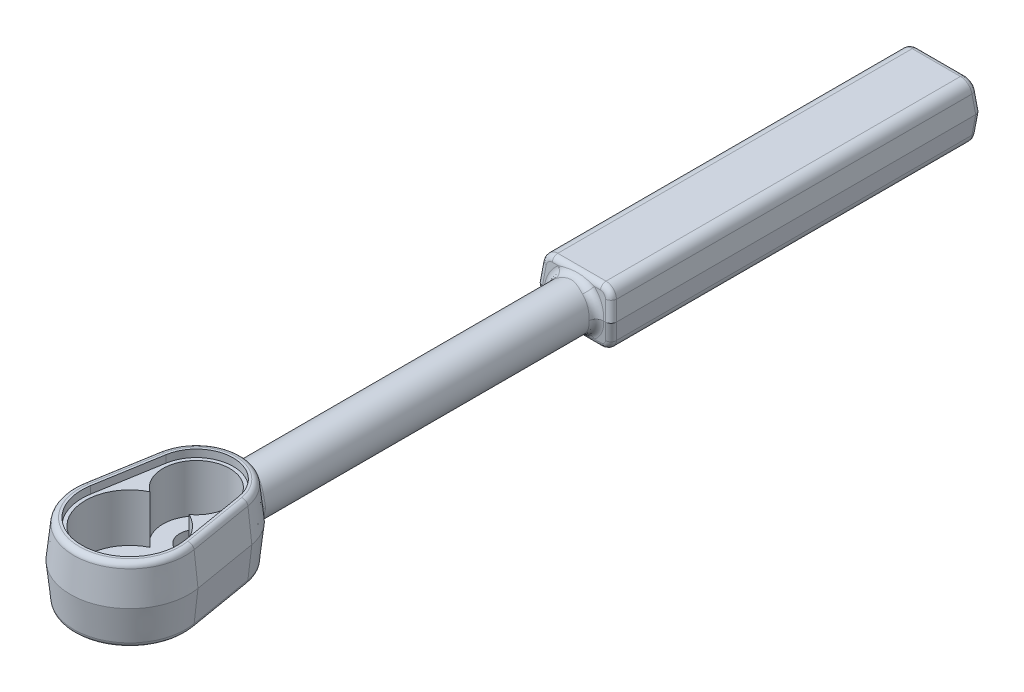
SolidWorks part; units mm, degrees
ref_plane "Front" through (0, 0, 0) normal (0, 0, 1) x (1, 0, 0)
ref_plane "Top" through (0, 0, 0) normal (0, 1, 0) x (1, 0, 0)
ref_plane "Right" through (0, 0, 0) normal (1, 0, 0) x (0, 0, -1)
sketch "Sketch2" plane through (0, 0, 0) normal (0, 1, 0) x (1, 0, 0)
  line L0 (0, 0) -> (0, 120) construction
  line L1 (-10, 220) -> (10, 220)
  line L2 (-10, 220) -> (-10, 120)
  line L3 (-10, 120) -> (10, 120)
  line L4 (10, 220) -> (10, 120)
  dimension "D1" = 220
  dimension "D2" = 20
  dimension "D3" = 100
extrude "Handle" add sketch "Sketch2" along normal mid plane 15 draft 6
sketch "Sketch3" plane through (0, 0, 0) normal (0, 0, 1) x (1, 0, 0)
  circle A0 centre (0, 0) radius 6
  dimension "D1" = 12
extrude "Transition" add sketch "Sketch3" against normal up to next
sketch "Sketch4" plane through (0, 0, 0) normal (0, 1, 0) x (1, 0, 0)
  line L0 (-15.7762, 2.6667) -> (-12.8182, 20.1667)
  line L1 (12.8182, 20.1667) -> (15.7762, 2.6667)
  line L2 (0, 0) -> (0, 39.2442) construction
  line L3 (0, 120) -> (0, 0) construction
  arc A0 (-12.8182, 20.1667) -> (12.8182, 20.1667) centre (0, 18) cw
  arc A1 (15.7762, 2.6667) -> (-15.7762, 2.6667) centre (0, 0) cw
  dimension "D1" = 13
  dimension "D2" = 16
  dimension "D3" = 18
extrude "Head" add sketch "Sketch4" along normal mid plane 20
sketch "Sketch5" plane through (0, 10, 0) normal (0, 1, 0) x (-1, 0, 0)
  line L6 (-12.7678, -2.1582) -> (-9.8098, -19.6582)
  line L7 (9.8098, -19.6582) -> (12.7678, -2.1582)
  line L8 (-12.7678, -2.1582) -> (-9.8098, -19.6582)
  line L9 (9.8098, -19.6582) -> (12.7678, -2.1582)
  arc A6 (12.7678, -2.1582) -> (-12.7678, -2.1582) centre (0, 0) ccw
  arc A7 (-9.8098, -19.6582) -> (9.8098, -19.6582) centre (0, -18) ccw
  arc A8 (12.7678, -2.1582) -> (-12.7678, -2.1582) centre (0, 0) ccw
  arc A9 (-9.8098, -19.6582) -> (9.8098, -19.6582) centre (0, -18) ccw
  dimension "D1" = 2
extrude "Recess" cut sketch "Sketch5" against normal blind 2
sketch "Sketch6" plane through (0, 8, 0) normal (0, 1, 0) x (-1, 0, 0)
  arc A0 (-5.3327, -10.75) -> (5.3327, -10.75) centre (0, -18) ccw
  arc A1 (5.3327, -10.75) -> (-5.3327, -10.75) centre (0, 0) ccw
  arc A3 (12.7678, -2.1582) -> (-12.7678, -2.1582) centre (0, 0) ccw construction
  dimension "D1" = 18
  dimension "D2" = 24
extrude "Pocket" cut sketch "Sketch6" against normal blind 13
sketch "Sketch7" plane through (0, -5, 0) normal (0, 1, 0) x (-1, 0, 0)
  circle A0 centre (0, -18) radius 4.5
  dimension "D1" = 9
extrude "WheelHole" cut sketch "Sketch7" against normal through all
extrude "RatchetHole" cut sketch "Sketch8" against normal through all
sketch "Sketch8" plane through (-4.6401, -5, 13.5993) normal (0, 1, 0) x (-1, 0, 0)
  circle A0 centre (-4.6401, -13.5993) radius 4.5
  arc A1 (10.0998, -16.0908) -> (-19.38, -16.0908) centre (-4.6401, -13.5993) ccw construction
  dimension "D1" = 9
fillet "HandleFillets" radius 3 4 edges at (9.2117, 7.5, -170) (-9.2117, -7.5, -170) (9.2117, -7.5, -170) (-9.2117, 7.5, -170)
fillet "H End Fillets" radius 1.5 28 edges at (0, 10, 14.949) (13.2609, 10, -11.2415) (0, 10, -29.949) (-13.2609, 10, -11.2415) (0, -10, 14.949) (-13.2609, -10, -11.2415) (0, -10, -29.949) (13.2609, -10, -11.2415) (-9.747, -2.4068, -219.747) (-9.747, -2.4068, -120.253) (0, -7.5, -120.7883) (9.747, -2.4068, -120.253) (8.5179, -6.7294, -120.7073) (-8.5179, -6.7294, -120.7073) (0, -7.5, -219.2117) (9.747, -2.4068, -219.747) (8.5179, -6.7294, -219.2927) (-8.5179, -6.7294, -219.2927) (0, 7.5, -120.7883) (0, 7.5, -219.2117) (9.747, 2.4068, -120.253) (-9.747, 2.4068, -120.253) (8.5179, 6.7294, -120.7073) (-8.5179, 6.7294, -120.7073) (-9.747, 2.4068, -219.747) (9.747, 2.4068, -219.747) (8.5179, 6.7294, -219.2927) (-8.5179, 6.7294, -219.2927)
fillet "TransFillet" radius 2 4 edges at (0, 6, -120.6306) (0, -6, -120.6306) (0.2191, -5.996, -30.3679) (0.2191, 5.996, -30.3679)
